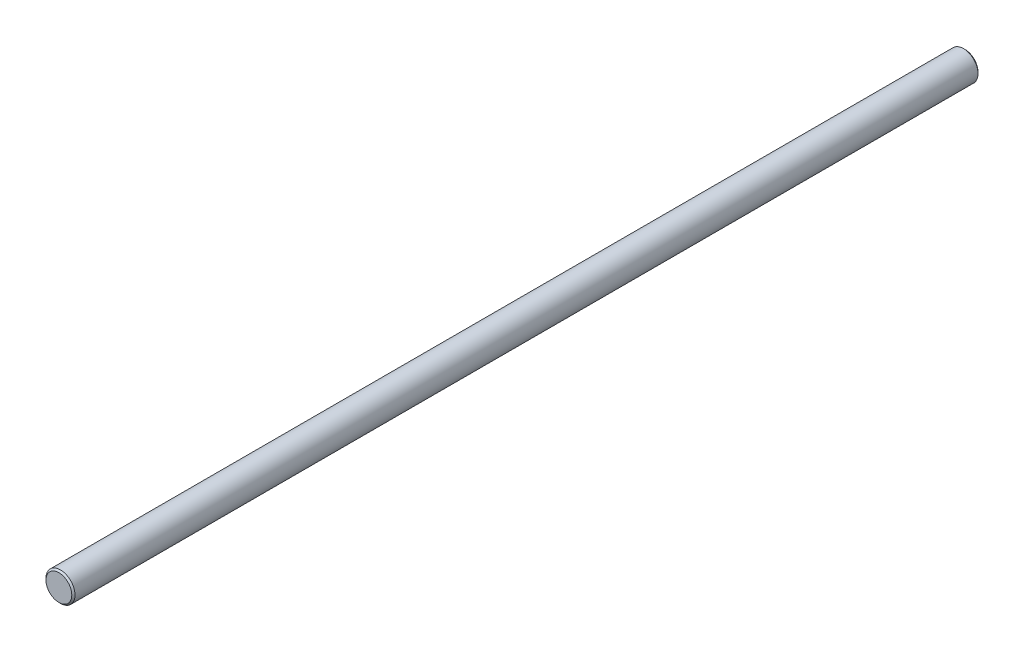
SolidWorks part; units mm, degrees
ref_plane "Спереди" through (0, 0, 0) normal (0, 0, 1) x (1, 0, 0)
ref_plane "Сверху" through (0, 0, 0) normal (0, 1, 0) x (1, 0, 0)
ref_plane "Справа" through (0, 0, 0) normal (1, 0, 0) x (0, 0, -1)
sketch "Эскиз1" plane through (0, 0, 0) normal (0, 0, 1) x (1, 0, 0)
  circle A0 centre (0, 0) radius 4.5
  dimension "D1" = 9
extrude "Бобышка-Вытянуть1" add sketch "Эскиз1" along normal mid plane 281
chamfer "Фаска1" distance 0.5 angle 45 2 edges at (4.5, 0, -140.5) (4.5, 0, 140.5)
